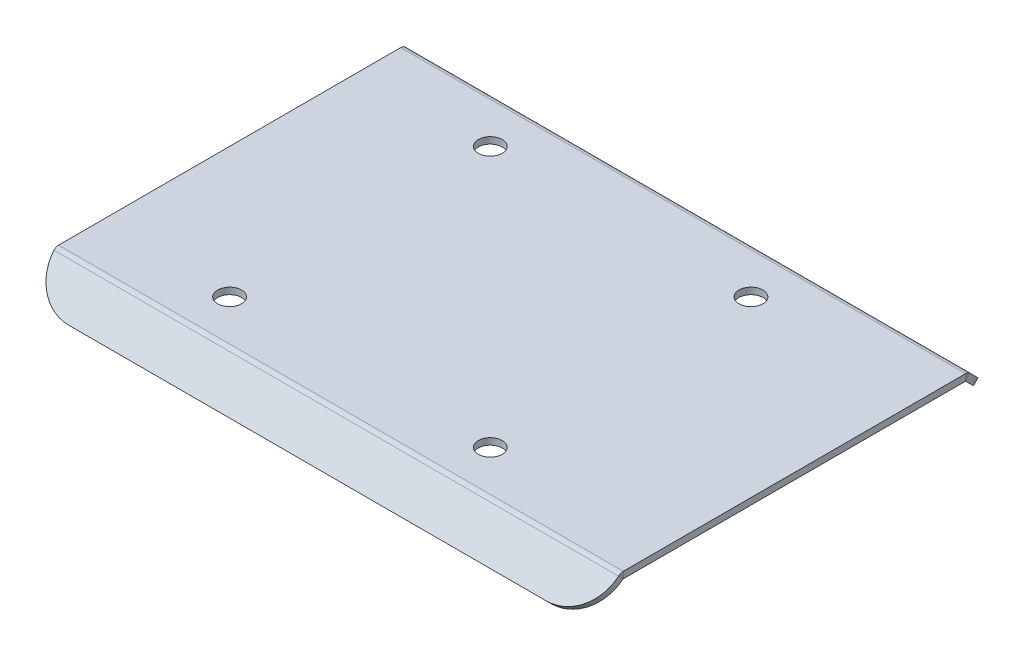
SolidWorks part; units mm, degrees
ref_plane "Front" through (0, 0, 0) normal (0, 0, 1) x (1, 0, 0)
ref_plane "Top" through (0, 0, 0) normal (0, 1, 0) x (1, 0, 0)
ref_plane "Right" through (0, 0, 0) normal (1, 0, 0) x (0, 0, -1)
sketch "Sketch1" plane through (0, 0, 0) normal (0, 1, 0) x (1, 0, 0)
  line L0 (10, -0.7377) -> (120, -0.7377)
  line L1 (130, 9.2623) -> (130, 89.2623)
  line L2 (120, 99.2623) -> (10, 99.2623)
  line L3 (0, 89.2623) -> (0, 9.2623)
  circle A0 centre (30, 79.2623) radius 2.75
  circle A1 centre (90, 79.2623) radius 2.75
  circle A2 centre (30, 19.2623) radius 2.75
  circle A3 centre (90, 19.2623) radius 2.75
  arc A4 (0, 89.2623) -> (10, 99.2623) centre (10, 89.2623) cw
  arc A5 (10, -0.7377) -> (0, 9.2623) centre (10, 9.2623) cw
  arc A6 (130, 9.2623) -> (120, -0.7377) centre (120, 9.2623) cw
  arc A7 (120, 99.2623) -> (130, 89.2623) centre (120, 89.2623) cw
  point P6 (0, 99.2623)
  point P9 (0, -0.7377)
  point P20 (130, -0.7377)
sheet metal parameters "Sheet-Metal1" thickness 1.5 parameters "D1"=0.01
base flange "Base-Flange1" sketch "Sketch1" thickness 1.5 reverse thickness direction yes parameters "D1"=0.01
sketch "Sketch3" plane through (0, 1.5, 0) normal (0, 1, 0) x (-1, 0, 0)
  line L0 (-10, -89.2623) -> (-120, -89.2623)
  line L1 (-10, -9.2623) -> (-120, -9.2623)
sketched bend "Sketched Bend1" parameters "D1"=0
bend "SketchBend1" bend radius 0.01 bend angle 45 parameters "D5"=1
bend "SketchBend2" bend radius 0 bend angle 45 parameters "D5"=2
flat pattern "Flat-Pattern1"
sketch "Bend-Lines1" plane through (0, 1.5, 0) normal (0, 1, 0) x (-1, 0, 0)
  line L0 (-130, -9.2623) -> (0, -9.2623) construction
  line L1 (-130, -89.2623) -> (0, -89.2623) construction
bend of the flat pattern "Flatten-<SketchBend1>1"
bend of the flat pattern "Flatten-<SketchBend2>1"
